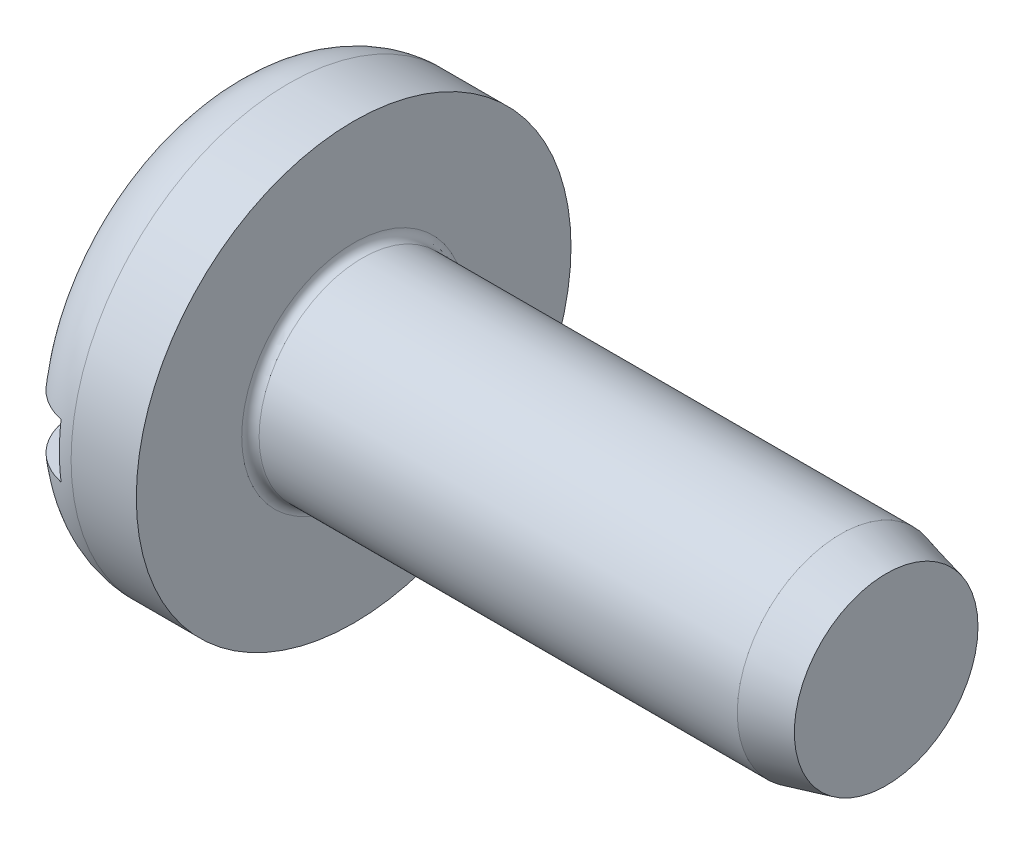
SolidWorks part; units mm, degrees
ref_plane "Front" through (0, 0, 0) normal (0, 0, 1) x (1, 0, 0)
ref_plane "Top" through (0, 0, 0) normal (0, 1, 0) x (1, 0, 0)
ref_plane "Right" through (0, 0, 0) normal (1, 0, 0) x (0, 0, -1)
sketch "Sketch1" plane through (0, 0, 0) normal (0, 0, 1) x (1, 0, 0)
  line L0 (-65.8852, 0) -> (41.8165, 0) construction
  line L1 (30.5, 0) -> (30.5, 4.75)
  line L2 (30.5, 4.75) -> (6, 4.75)
  line L3 (6, 4.75) -> (6, 10)
  line L4 (6, 10) -> (3, 10)
  line L5 (30.5, 0) -> (0, 0)
  line L6 (0, 7) -> (0, 0)
  line L7 (8.1, 7) -> (8.1, -1.5464) construction
  arc A0 (3, 10) -> (0, 7) centre (3, 7) ccw
  dimension "rf" = 3
  dimension "st" = 9.5
  dimension "k" = 6
  dimension "l" = 24.5
  dimension "dk" = 20
  dimension "a" = 2.1
revolve "Base" add sketch "Sketch1" angle 360 about L0
sketch "Sketch2" plane through (0, 0, 0) normal (0, 0, 1) x (1, 0, 0)
  line L1 (0, 1.25) -> (2.4, 1.25)
  line L2 (0, 1.25) -> (0, -1.25)
  line L3 (0, -1.25) -> (2.4, -1.25)
  line L4 (2.4, 1.25) -> (2.4, -1.25)
  line L5 (0, 7) -> (0, -7) construction
  line L6 (1.1738, 0) -> (-4.2219, 0) construction
  dimension "n" = 2.5
  dimension "t" = 2.4
extrude "Slot" cut sketch "Sketch2" against normal through all and the other way through all
fillet "Fillet1" radius 0.4 1 edges at (6, 0, 4.75)
sketch "Sketch3" plane through (0, 0, 0) normal (0, 0, 1) x (1, 0, 0)
  line L0 (1.3282, 0) -> (-13.6388, 0) construction
  line L2 (26.3, -4.75) -> (28.4, -4.75)
  line L3 (28.4, -4.75) -> (30.5, -4.225)
  line L6 (26.3, -4.75) -> (26.3, -5.25)
  line L7 (26.3, -5.25) -> (30.5, -5.25)
  line L8 (30.5, -5.25) -> (30.5, -4.225)
  line L9 (30.5, -4.75) -> (30.5, 4.75) construction
  line L10 (6.4, -4.75) -> (30.5, -4.75) construction
  point P15 (28.4, -4.75)
  dimension "yf" = 4.2
  dimension "D2" = 2.1
  dimension "D3" = 0.525
  dimension "D4" = 0.5
revolve "Cut-Revolve1" cut sketch "Sketch3" angle 360 about L0
sketch "Sketch4" plane through (0, 0, 0) normal (0, 0, 1) x (1, 0, 0)
  line L0 (33.2407, 0) -> (9.9121, 0) construction
  line L2 (30.5, -4.75) -> (30.5, 4.75) construction
  line L3 (30.5, 0) -> (22.5, -4.75) construction
  line L6 (30.5, 0) -> (31, 0)
  line L7 (22.5, -4.75) -> (30.5, -4.75)
  line L8 (31, 0) -> (31, -4.75)
  line L9 (31, -4.75) -> (30.5, -4.75)
  arc A0 (30.5, 0) -> (22.5, -4.75) centre (10.3363, 24.8481) cw
  dimension "D1" = 32
  dimension "D2" = 0.5
  dimension "yc" = 8
  dimension "D3" = 9.5
revolve "Cut-Revolve6" [suppressed] cut sketch "Sketch4" angle 360 about L0
sketch "Sketch5" plane through (0, 0, 0) normal (0, 0, 1) x (1, 0, 0)
  line L0 (7.85, 5.25) -> (8.35, 5.25)
  line L1 (8.35, 5.25) -> (8.35, 4.75)
  line L2 (8.35, 4.75) -> (8.1, 4.317)
  line L3 (8.1, 4.317) -> (7.85, 4.75)
  line L4 (7.85, 4.75) -> (7.85, 5.25)
  line L5 (0, 0) -> (1.9875, 0) construction
  line L6 (6, -10) -> (6, 10) construction
  dimension "D1" = 9.5
  dimension "D2" = 0.5
  dimension "D3" = 2.1
revolve "Cut-Revolve10" [suppressed] cut sketch "Sketch5" angle 360 about L5
pattern_linear "LPattern10" [suppressed] count 37 spacing 0.6 along (1, 0, 0)
equation "\"D3@Sketch3\" = \"yf@Sketch3\" / 8"
equation "\"D2@ThreadCosmetic1\" = \"st@Sketch1\" - 1"
equation "\"D1@Sketch4\" = \"yc@Sketch4\" * 4"
equation "\"D3@Sketch4\" = \"st@Sketch1\""
equation "\"D2@Sketch3\" = \"yf@Sketch3\" / 2"
equation "\"D1@ThreadCosmetic1\" = \"l@Sketch1\" - \"a@Sketch1\""
equation "\"D1@Sketch5\" = \"st@Sketch1\""
equation "\"D2@Sketch5\" =  ( \"st@Sketch1\" - \"D2@ThreadCosmetic1\" )  / 2"
equation "\"D3@Sketch5\" = \"a@Sketch1\""
equation "\"D3@LPattern10\" =  ( \"st@Sketch1\" - \"D2@ThreadCosmetic1\" )  / 2 * 1.2"
equation "\"D1@LPattern10\" = \"D1@ThreadCosmetic1\" / \"D3@LPattern10\""
